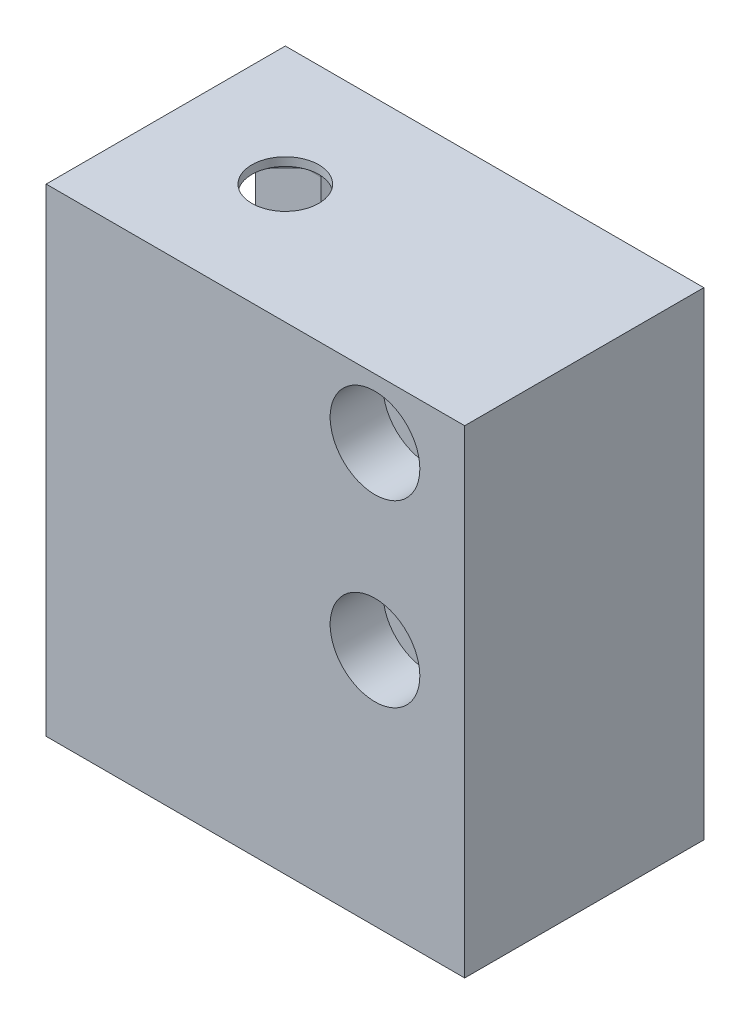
SolidWorks part; units mm, degrees
ref_plane "Front Plane" through (0, 0, 0) normal (0, 0, 1) x (1, 0, 0)
ref_plane "Top Plane" through (0, 0, 0) normal (0, 1, 0) x (1, 0, 0)
ref_plane "Right Plane" through (0, 0, 0) normal (1, 0, 0) x (0, 0, -1)
sketch "Sketch1" plane through (0, 0, 0) normal (0, 1, 0) x (1, 0, 0)
  line L1 (-22.225, -12.7) -> (22.225, -12.7)
  line L2 (-22.225, -12.7) -> (-22.225, 12.7)
  line L3 (-22.225, 12.7) -> (22.225, 12.7)
  line L4 (22.225, -12.7) -> (22.225, 12.7)
  line L5 (-22.225, -12.7) -> (22.225, 12.7) construction
  line L6 (-22.225, 12.7) -> (22.225, -12.7) construction
  point P0 (0, 0)
  dimension "D1" = 44.45
  dimension "D2" = 25.4
extrude "Boss-Extrude1" add sketch "Sketch1" along normal blind 50.8
sketch "Sketch2" plane through (0, 0, 0) normal (0, -1, 0) x (1, 0, 0)
  line L0 (-22.225, -12.7) -> (-22.225, 12.7) construction
  line L1 (-22.225, 0) -> (49977.775, 0) construction
  circle A0 centre (4.7752, 0) radius 4.7625
  point P6 (-22.225, 0)
  dimension "D1" = 9.525
  dimension "D2" = 27.0002
extrude "Cut-Extrude1" cut sketch "Sketch2" against normal blind 3.175
hole_wizard "Hole1" positions "Sketch4" profile "Sketch3" legacy
sketch "Sketch4" plane through (0, 3.175, 0) normal (0, -1, 0) x (1, 0, 0)
  circle A0 centre (4.7752, 0) radius 4.7625 construction
  point P0 (4.7752, 0)
sketch "Sketch3" plane through (4.7752, 3.175, 0) normal (1, 0, 0) x (0, 0, -1)
  line L0 (0, 0) -> (0, 15.6739)
  line L1 (0, 15.6739) -> (2.413, 14.224)
  line L2 (2.413, 14.224) -> (2.413, 0)
  line L4 (2.413, 0) -> (0, 0)
  line L6 (0, 15.6739) -> (-2.413, 14.224) construction
  line L7 (0, -4.2442) -> (0, 117.3081) construction
  dimension "Diameter" = 4.826
  dimension "Depth" = 14.224
  dimension "Drill Angle" = 118
sketch "Sketch5" plane through (0, 0, 0) normal (0, -1, 0) x (1, 0, 0)
  line L0 (-22.225, 0) -> (49977.775, 0) construction
  line L1 (-22.225, -12.7) -> (-22.225, 12.7) construction
  circle A0 centre (-9.525, 0) radius 11.1125
  point P6 (-22.225, 0)
  dimension "D1" = 22.225
  dimension "D2" = 12.7
extrude "Cut-Extrude2" cut sketch "Sketch5" against normal blind 49.911
sketch "Sketch6" plane through (-22.225, 0, 0) normal (-1, 0, 0) x (0, 0, 1)
  line L0 (-12.7, 0) -> (12.7, 0) construction
  line L1 (-9.525, 0) -> (9.525, 0)
  line L2 (-9.525, 0) -> (-9.525, 44.45)
  line L3 (-9.525, 44.45) -> (9.525, 44.45)
  line L4 (9.525, 0) -> (9.525, 44.45)
  line L5 (0, 50.8) -> (0, -49949.2) construction
  line L6 (-12.7, 50.8) -> (12.7, 50.8) construction
  point P10 (0, 50.8)
  dimension "D1" = 19.05
  dimension "D2" = 44.45
extrude "Cut-Extrude3" cut sketch "Sketch6" against normal up to next
hole_wizard "CBORE for #10 Socket Head Cap Screw1" positions "Sketch9" profile "Sketch8" counterbore size "#10" standard "Ansi Inch"
sketch "Sketch9" plane through (0, 0, 12.7) normal (0, 0, 1) x (1, 0, 0)
  line L0 (22.225, 50.8) -> (22.225, 0) construction
  line L1 (-22.225, 50.8) -> (22.225, 50.8) construction
  point P0 (12.7, 25.4)
  point P1 (12.7, 44.45)
  dimension "D1" = 9.525
  dimension "D2" = 6.35
  dimension "D3" = 25.4
sketch "Sketch8" plane through (12.7, 25.4, 12.7) normal (1, 0, 0) x (0, -1, 0)
  line L0 (0, 0) -> (0, 14.2338)
  line L1 (0, 14.2338) -> (2.5527, 12.7)
  line L2 (2.5527, 12.7) -> (2.5527, 5.6134)
  line L3 (2.5527, 5.6134) -> (4.7625, 5.6134)
  line L4 (4.7625, 5.6134) -> (4.7625, 0)
  line L5 (4.7625, 0) -> (0, 0)
  line L10 (0, 14.2338) -> (-2.5527, 12.7) construction
  line L11 (0, -6.35) -> (0, 107.95) construction
  dimension "Hole Dia." = 5.1054
  dimension "Hole Depth" = 12.7
  dimension "C'Bore Dia." = 9.525
  dimension "C'Bore Depth" = 5.6134
  dimension "Drill Angle" = 118
hole_wizard "CBORE for #10 Socket Head Cap Screw2" positions "Sketch11" profile "Sketch10" counterbore size "#10" standard "Ansi Inch"
sketch "Sketch11" plane through (0, 0, -12.7) normal (0, 0, -1) x (-1, 0, 0)
  circle A0 centre (-12.7, 44.45) radius 4.7625 construction
  circle A1 centre (-12.7, 25.4) radius 4.7625 construction
  point P0 (-12.7, 44.45)
  point P1 (-12.7, 25.4)
sketch "Sketch10" plane through (12.7, 44.45, -12.7) normal (1, 0, 0) x (0, 1, 0)
  line L0 (0, 0) -> (0, 25.4)
  line L1 (0, 25.4) -> (2.5527, 25.4)
  line L3 (2.5527, 25.4) -> (2.5527, 6.4084)
  line L4 (2.5527, 6.4084) -> (4.7625, 6.4084)
  line L5 (4.7625, 6.4084) -> (4.7625, 0)
  line L7 (4.7625, 0) -> (0, 0)
  line L11 (0, -6.35) -> (0, 107.95) construction
  dimension "Thru Hole Dia." = 5.1054
  dimension "Thru Hole Depth" = 25.4
  dimension "C'Bore Dia." = 9.525
  dimension "C'Bore Depth" = 6.4084
sketch "Sketch12" plane through (0, 49.911, 0) normal (0, -1, 0) x (1, 0, 0)
  circle A0 centre (-9.525, 0) radius 3.556
  circle A1 centre (-9.525, 0) radius 11.1125 construction
  dimension "D1" = 7.112
extrude "Cut-Extrude4" cut sketch "Sketch12" against normal through all
fillet "Fillet1" radius 0.635 3 edges at (-9.525, 49.911, -11.1125) (-18.7369, 44.45, 9.525) (-18.7369, 44.45, -9.525)
